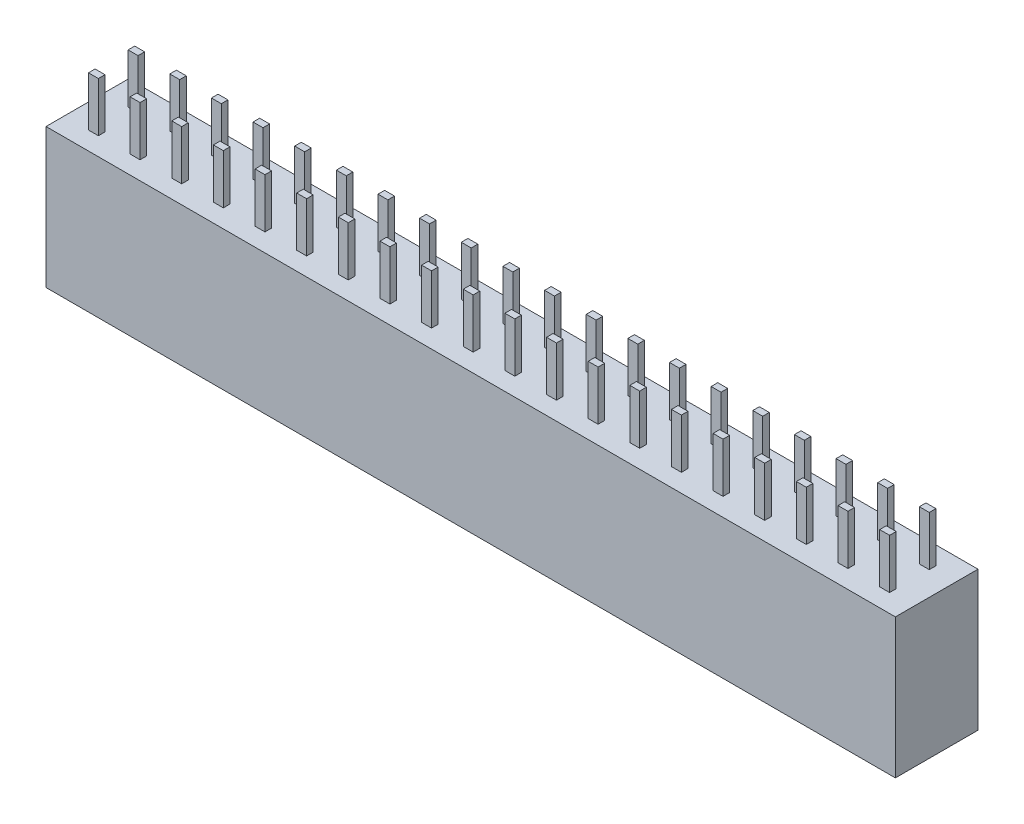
SolidWorks part; units mm, degrees
ref_plane "Front Plane" through (0, 0, 0) normal (0, 0, 1) x (1, 0, 0)
ref_plane "Top Plane" through (0, 0, 0) normal (0, 1, 0) x (1, 0, 0)
ref_plane "Right Plane" through (0, 0, 0) normal (1, 0, 0) x (0, 0, -1)
sketch "Sketch1" plane through (0, 0, 0) normal (0, 1, 0) x (1, 0, 0)
  line L1 (-25.7, 2.5) -> (25.7, 2.5)
  line L2 (-25.7, 2.5) -> (-25.7, -2.5)
  line L3 (-25.7, -2.5) -> (25.7, -2.5)
  line L4 (25.7, 2.5) -> (25.7, -2.5)
  line L5 (-25.7, 2.5) -> (25.7, -2.5) construction
  line L6 (-25.7, -2.5) -> (25.7, 2.5) construction
  point P0 (0, 0)
  dimension "D1" = 51.4
  dimension "D2" = 5
extrude "Boss-Extrude1" add sketch "Sketch1" along normal blind 8.44
sketch "Sketch2" plane through (0, 0, 0) normal (0, -1, 0) x (1, 0, 0)
  line L0 (-25.7, 2.5) -> (25.7, 2.5) construction
  line L1 (24.7, 2) -> (23.2, 2)
  line L2 (24.7, 2) -> (24.7, 0.5)
  line L3 (24.7, 0.5) -> (23.2, 0.5)
  line L4 (23.2, 2) -> (23.2, 0.5)
  line L5 (24.7, -0.5) -> (23.2, -0.5)
  line L6 (24.7, -0.5) -> (24.7, -2)
  line L7 (24.7, -2) -> (23.2, -2)
  line L8 (23.2, -0.5) -> (23.2, -2)
  line L9 (25.7, -2.5) -> (-25.7, -2.5) construction
  line L10 (25.7, 2.5) -> (25.7, -2.5) construction
  line L11 (22.18, 2) -> (20.68, 2)
  line L12 (22.18, 2) -> (22.18, 0.5)
  line L13 (22.18, 0.5) -> (20.68, 0.5)
  line L14 (20.68, 2) -> (20.68, 0.5)
  line L15 (22.18, -0.5) -> (20.68, -0.5)
  line L16 (22.18, -0.5) -> (22.18, -2)
  line L17 (22.18, -2) -> (20.68, -2)
  line L18 (20.68, -0.5) -> (20.68, -2)
  line L19 (19.66, 2) -> (18.16, 2)
  line L20 (19.66, 2) -> (19.66, 0.5)
  line L21 (19.66, 0.5) -> (18.16, 0.5)
  line L22 (18.16, 2) -> (18.16, 0.5)
  line L23 (19.66, -0.5) -> (18.16, -0.5)
  line L24 (19.66, -0.5) -> (19.66, -2)
  line L25 (19.66, -2) -> (18.16, -2)
  line L26 (18.16, -0.5) -> (18.16, -2)
  line L27 (17.14, 2) -> (15.64, 2)
  line L28 (17.14, 2) -> (17.14, 0.5)
  line L29 (17.14, 0.5) -> (15.64, 0.5)
  line L30 (15.64, 2) -> (15.64, 0.5)
  line L31 (17.14, -0.5) -> (15.64, -0.5)
  line L32 (17.14, -0.5) -> (17.14, -2)
  line L33 (17.14, -2) -> (15.64, -2)
  line L34 (15.64, -0.5) -> (15.64, -2)
  line L35 (14.62, 2) -> (13.12, 2)
  line L36 (14.62, 2) -> (14.62, 0.5)
  line L37 (14.62, 0.5) -> (13.12, 0.5)
  line L38 (13.12, 2) -> (13.12, 0.5)
  line L39 (14.62, -0.5) -> (13.12, -0.5)
  line L40 (14.62, -0.5) -> (14.62, -2)
  line L41 (14.62, -2) -> (13.12, -2)
  line L42 (13.12, -0.5) -> (13.12, -2)
  line L43 (12.1, 2) -> (10.6, 2)
  line L44 (12.1, 2) -> (12.1, 0.5)
  line L45 (12.1, 0.5) -> (10.6, 0.5)
  line L46 (10.6, 2) -> (10.6, 0.5)
  line L47 (12.1, -0.5) -> (10.6, -0.5)
  line L48 (12.1, -0.5) -> (12.1, -2)
  line L49 (12.1, -2) -> (10.6, -2)
  line L50 (10.6, -0.5) -> (10.6, -2)
  line L51 (9.58, 2) -> (8.08, 2)
  line L52 (9.58, 2) -> (9.58, 0.5)
  line L53 (9.58, 0.5) -> (8.08, 0.5)
  line L54 (8.08, 2) -> (8.08, 0.5)
  line L55 (9.58, -0.5) -> (8.08, -0.5)
  line L56 (9.58, -0.5) -> (9.58, -2)
  line L57 (9.58, -2) -> (8.08, -2)
  line L58 (8.08, -0.5) -> (8.08, -2)
  line L59 (7.06, 2) -> (5.56, 2)
  line L60 (7.06, 2) -> (7.06, 0.5)
  line L61 (7.06, 0.5) -> (5.56, 0.5)
  line L62 (5.56, 2) -> (5.56, 0.5)
  line L63 (7.06, -0.5) -> (5.56, -0.5)
  line L64 (7.06, -0.5) -> (7.06, -2)
  line L65 (7.06, -2) -> (5.56, -2)
  line L66 (5.56, -0.5) -> (5.56, -2)
  line L67 (4.54, 2) -> (3.04, 2)
  line L68 (4.54, 2) -> (4.54, 0.5)
  line L69 (4.54, 0.5) -> (3.04, 0.5)
  line L70 (3.04, 2) -> (3.04, 0.5)
  line L71 (4.54, -0.5) -> (3.04, -0.5)
  line L72 (4.54, -0.5) -> (4.54, -2)
  line L73 (4.54, -2) -> (3.04, -2)
  line L74 (3.04, -0.5) -> (3.04, -2)
  line L75 (2.02, 2) -> (0.52, 2)
  line L76 (2.02, 2) -> (2.02, 0.5)
  line L77 (2.02, 0.5) -> (0.52, 0.5)
  line L78 (0.52, 2) -> (0.52, 0.5)
  line L79 (2.02, -0.5) -> (0.52, -0.5)
  line L80 (2.02, -0.5) -> (2.02, -2)
  line L81 (2.02, -2) -> (0.52, -2)
  line L82 (0.52, -0.5) -> (0.52, -2)
  line L83 (-0.5, 2) -> (-2, 2)
  line L84 (-0.5, 2) -> (-0.5, 0.5)
  line L85 (-0.5, 0.5) -> (-2, 0.5)
  line L86 (-2, 2) -> (-2, 0.5)
  line L87 (-0.5, -0.5) -> (-2, -0.5)
  line L88 (-0.5, -0.5) -> (-0.5, -2)
  line L89 (-0.5, -2) -> (-2, -2)
  line L90 (-2, -0.5) -> (-2, -2)
  line L91 (-3.02, 2) -> (-4.52, 2)
  line L92 (-3.02, 2) -> (-3.02, 0.5)
  line L93 (-3.02, 0.5) -> (-4.52, 0.5)
  line L94 (-4.52, 2) -> (-4.52, 0.5)
  line L95 (-3.02, -0.5) -> (-4.52, -0.5)
  line L96 (-3.02, -0.5) -> (-3.02, -2)
  line L97 (-3.02, -2) -> (-4.52, -2)
  line L98 (-4.52, -0.5) -> (-4.52, -2)
  line L99 (-5.54, 2) -> (-7.04, 2)
  line L100 (-5.54, 2) -> (-5.54, 0.5)
  line L101 (-5.54, 0.5) -> (-7.04, 0.5)
  line L102 (-7.04, 2) -> (-7.04, 0.5)
  line L103 (-5.54, -0.5) -> (-7.04, -0.5)
  line L104 (-5.54, -0.5) -> (-5.54, -2)
  line L105 (-5.54, -2) -> (-7.04, -2)
  line L106 (-7.04, -0.5) -> (-7.04, -2)
  line L107 (-8.06, 2) -> (-9.56, 2)
  line L108 (-8.06, 2) -> (-8.06, 0.5)
  line L109 (-8.06, 0.5) -> (-9.56, 0.5)
  line L110 (-9.56, 2) -> (-9.56, 0.5)
  line L111 (-8.06, -0.5) -> (-9.56, -0.5)
  line L112 (-8.06, -0.5) -> (-8.06, -2)
  line L113 (-8.06, -2) -> (-9.56, -2)
  line L114 (-9.56, -0.5) -> (-9.56, -2)
  line L115 (-10.58, 2) -> (-12.08, 2)
  line L116 (-10.58, 2) -> (-10.58, 0.5)
  line L117 (-10.58, 0.5) -> (-12.08, 0.5)
  line L118 (-12.08, 2) -> (-12.08, 0.5)
  line L119 (-10.58, -0.5) -> (-12.08, -0.5)
  line L120 (-10.58, -0.5) -> (-10.58, -2)
  line L121 (-10.58, -2) -> (-12.08, -2)
  line L122 (-12.08, -0.5) -> (-12.08, -2)
  line L123 (-13.1, 2) -> (-14.6, 2)
  line L124 (-13.1, 2) -> (-13.1, 0.5)
  line L125 (-13.1, 0.5) -> (-14.6, 0.5)
  line L126 (-14.6, 2) -> (-14.6, 0.5)
  line L127 (-13.1, -0.5) -> (-14.6, -0.5)
  line L128 (-13.1, -0.5) -> (-13.1, -2)
  line L129 (-13.1, -2) -> (-14.6, -2)
  line L130 (-14.6, -0.5) -> (-14.6, -2)
  line L131 (-15.62, 2) -> (-17.12, 2)
  line L132 (-15.62, 2) -> (-15.62, 0.5)
  line L133 (-15.62, 0.5) -> (-17.12, 0.5)
  line L134 (-17.12, 2) -> (-17.12, 0.5)
  line L135 (-15.62, -0.5) -> (-17.12, -0.5)
  line L136 (-15.62, -0.5) -> (-15.62, -2)
  line L137 (-15.62, -2) -> (-17.12, -2)
  line L138 (-17.12, -0.5) -> (-17.12, -2)
  line L139 (-18.14, 2) -> (-19.64, 2)
  line L140 (-18.14, 2) -> (-18.14, 0.5)
  line L141 (-18.14, 0.5) -> (-19.64, 0.5)
  line L142 (-19.64, 2) -> (-19.64, 0.5)
  line L143 (-18.14, -0.5) -> (-19.64, -0.5)
  line L144 (-18.14, -0.5) -> (-18.14, -2)
  line L145 (-18.14, -2) -> (-19.64, -2)
  line L146 (-19.64, -0.5) -> (-19.64, -2)
  line L147 (-20.66, 2) -> (-22.16, 2)
  line L148 (-20.66, 2) -> (-20.66, 0.5)
  line L149 (-20.66, 0.5) -> (-22.16, 0.5)
  line L150 (-22.16, 2) -> (-22.16, 0.5)
  line L151 (-20.66, -0.5) -> (-22.16, -0.5)
  line L152 (-20.66, -0.5) -> (-20.66, -2)
  line L153 (-20.66, -2) -> (-22.16, -2)
  line L154 (-22.16, -0.5) -> (-22.16, -2)
  line L155 (-23.18, 2) -> (-24.68, 2)
  line L156 (-23.18, 2) -> (-23.18, 0.5)
  line L157 (-23.18, 0.5) -> (-24.68, 0.5)
  line L158 (-24.68, 2) -> (-24.68, 0.5)
  line L159 (-23.18, -0.5) -> (-24.68, -0.5)
  line L160 (-23.18, -0.5) -> (-23.18, -2)
  line L161 (-23.18, -2) -> (-24.68, -2)
  line L162 (-24.68, -0.5) -> (-24.68, -2)
  dimension "D1" = 0.5
  dimension "D2" = 0.5
  dimension "D3" = 1
  dimension "D4" = 1
  dimension "D5" = 1
  dimension "D6" = 1.5
  dimension "D7" = 20
extrude "Cut-Extrude1" cut sketch "Sketch2" against normal blind 5
sketch "Sketch3" plane through (0, 8.44, 0) normal (0, 1, 0) x (1, 0, 0)
  line L0 (23.95, 1) -> (23.95, -1) construction
  line L1 (23.65, 1.4) -> (24.25, 1.4)
  line L2 (23.65, 1.4) -> (23.65, 1)
  line L3 (23.65, 1) -> (24.25, 1)
  line L4 (24.25, 1.4) -> (24.25, 1)
  line L5 (23.65, -1) -> (24.25, -1)
  line L6 (23.65, -1) -> (23.65, -1.4)
  line L7 (23.65, -1.4) -> (24.25, -1.4)
  line L8 (24.25, -1) -> (24.25, -1.4)
  line L9 (23.95, 0) -> (25.7, 0) construction
  line L10 (25.7, -2.5) -> (25.7, 2.5) construction
  line L12 (23.95, 1.4) -> (23.95, 2) construction
  line L13 (23.2, 2) -> (24.7, 2) construction
  line L14 (21.13, 1) -> (21.73, 1)
  line L15 (21.73, 1.4) -> (21.73, 1)
  line L16 (21.13, 1.4) -> (21.73, 1.4)
  line L17 (21.13, 1.4) -> (21.13, 1)
  line L18 (21.13, -1) -> (21.13, -1.4)
  line L19 (21.13, -1) -> (21.73, -1)
  line L20 (21.13, -1.4) -> (21.73, -1.4)
  line L21 (21.73, -1) -> (21.73, -1.4)
  line L22 (18.61, 1) -> (19.21, 1)
  line L23 (19.21, 1.4) -> (19.21, 1)
  line L24 (18.61, 1.4) -> (19.21, 1.4)
  line L25 (18.61, 1.4) -> (18.61, 1)
  line L26 (18.61, -1) -> (18.61, -1.4)
  line L27 (18.61, -1) -> (19.21, -1)
  line L28 (18.61, -1.4) -> (19.21, -1.4)
  line L29 (19.21, -1) -> (19.21, -1.4)
  line L30 (16.09, 1) -> (16.69, 1)
  line L31 (16.69, 1.4) -> (16.69, 1)
  line L32 (16.09, 1.4) -> (16.69, 1.4)
  line L33 (16.09, 1.4) -> (16.09, 1)
  line L34 (16.09, -1) -> (16.09, -1.4)
  line L35 (16.09, -1) -> (16.69, -1)
  line L36 (16.09, -1.4) -> (16.69, -1.4)
  line L37 (16.69, -1) -> (16.69, -1.4)
  line L38 (13.57, 1) -> (14.17, 1)
  line L39 (14.17, 1.4) -> (14.17, 1)
  line L40 (13.57, 1.4) -> (14.17, 1.4)
  line L41 (13.57, 1.4) -> (13.57, 1)
  line L42 (13.57, -1) -> (13.57, -1.4)
  line L43 (13.57, -1) -> (14.17, -1)
  line L44 (13.57, -1.4) -> (14.17, -1.4)
  line L45 (14.17, -1) -> (14.17, -1.4)
  line L46 (11.05, 1) -> (11.65, 1)
  line L47 (11.65, 1.4) -> (11.65, 1)
  line L48 (11.05, 1.4) -> (11.65, 1.4)
  line L49 (11.05, 1.4) -> (11.05, 1)
  line L50 (11.05, -1) -> (11.05, -1.4)
  line L51 (11.05, -1) -> (11.65, -1)
  line L52 (11.05, -1.4) -> (11.65, -1.4)
  line L53 (11.65, -1) -> (11.65, -1.4)
  line L54 (8.53, 1) -> (9.13, 1)
  line L55 (9.13, 1.4) -> (9.13, 1)
  line L56 (8.53, 1.4) -> (9.13, 1.4)
  line L57 (8.53, 1.4) -> (8.53, 1)
  line L58 (8.53, -1) -> (8.53, -1.4)
  line L59 (8.53, -1) -> (9.13, -1)
  line L60 (8.53, -1.4) -> (9.13, -1.4)
  line L61 (9.13, -1) -> (9.13, -1.4)
  line L62 (6.01, 1) -> (6.61, 1)
  line L63 (6.61, 1.4) -> (6.61, 1)
  line L64 (6.01, 1.4) -> (6.61, 1.4)
  line L65 (6.01, 1.4) -> (6.01, 1)
  line L66 (6.01, -1) -> (6.01, -1.4)
  line L67 (6.01, -1) -> (6.61, -1)
  line L68 (6.01, -1.4) -> (6.61, -1.4)
  line L69 (6.61, -1) -> (6.61, -1.4)
  line L70 (3.49, 1) -> (4.09, 1)
  line L71 (4.09, 1.4) -> (4.09, 1)
  line L72 (3.49, 1.4) -> (4.09, 1.4)
  line L73 (3.49, 1.4) -> (3.49, 1)
  line L74 (3.49, -1) -> (3.49, -1.4)
  line L75 (3.49, -1) -> (4.09, -1)
  line L76 (3.49, -1.4) -> (4.09, -1.4)
  line L77 (4.09, -1) -> (4.09, -1.4)
  line L78 (0.97, 1) -> (1.57, 1)
  line L79 (1.57, 1.4) -> (1.57, 1)
  line L80 (0.97, 1.4) -> (1.57, 1.4)
  line L81 (0.97, 1.4) -> (0.97, 1)
  line L82 (0.97, -1) -> (0.97, -1.4)
  line L83 (0.97, -1) -> (1.57, -1)
  line L84 (0.97, -1.4) -> (1.57, -1.4)
  line L85 (1.57, -1) -> (1.57, -1.4)
  line L86 (-1.55, 1) -> (-0.95, 1)
  line L87 (-0.95, 1.4) -> (-0.95, 1)
  line L88 (-1.55, 1.4) -> (-0.95, 1.4)
  line L89 (-1.55, 1.4) -> (-1.55, 1)
  line L90 (-1.55, -1) -> (-1.55, -1.4)
  line L91 (-1.55, -1) -> (-0.95, -1)
  line L92 (-1.55, -1.4) -> (-0.95, -1.4)
  line L93 (-0.95, -1) -> (-0.95, -1.4)
  line L94 (-4.07, 1) -> (-3.47, 1)
  line L95 (-3.47, 1.4) -> (-3.47, 1)
  line L96 (-4.07, 1.4) -> (-3.47, 1.4)
  line L97 (-4.07, 1.4) -> (-4.07, 1)
  line L98 (-4.07, -1) -> (-4.07, -1.4)
  line L99 (-4.07, -1) -> (-3.47, -1)
  line L100 (-4.07, -1.4) -> (-3.47, -1.4)
  line L101 (-3.47, -1) -> (-3.47, -1.4)
  line L102 (-6.59, 1) -> (-5.99, 1)
  line L103 (-5.99, 1.4) -> (-5.99, 1)
  line L104 (-6.59, 1.4) -> (-5.99, 1.4)
  line L105 (-6.59, 1.4) -> (-6.59, 1)
  line L106 (-6.59, -1) -> (-6.59, -1.4)
  line L107 (-6.59, -1) -> (-5.99, -1)
  line L108 (-6.59, -1.4) -> (-5.99, -1.4)
  line L109 (-5.99, -1) -> (-5.99, -1.4)
  line L110 (-9.11, 1) -> (-8.51, 1)
  line L111 (-8.51, 1.4) -> (-8.51, 1)
  line L112 (-9.11, 1.4) -> (-8.51, 1.4)
  line L113 (-9.11, 1.4) -> (-9.11, 1)
  line L114 (-9.11, -1) -> (-9.11, -1.4)
  line L115 (-9.11, -1) -> (-8.51, -1)
  line L116 (-9.11, -1.4) -> (-8.51, -1.4)
  line L117 (-8.51, -1) -> (-8.51, -1.4)
  line L118 (-11.63, 1) -> (-11.03, 1)
  line L119 (-11.03, 1.4) -> (-11.03, 1)
  line L120 (-11.63, 1.4) -> (-11.03, 1.4)
  line L121 (-11.63, 1.4) -> (-11.63, 1)
  line L122 (-11.63, -1) -> (-11.63, -1.4)
  line L123 (-11.63, -1) -> (-11.03, -1)
  line L124 (-11.63, -1.4) -> (-11.03, -1.4)
  line L125 (-11.03, -1) -> (-11.03, -1.4)
  line L126 (-14.15, 1) -> (-13.55, 1)
  line L127 (-13.55, 1.4) -> (-13.55, 1)
  line L128 (-14.15, 1.4) -> (-13.55, 1.4)
  line L129 (-14.15, 1.4) -> (-14.15, 1)
  line L130 (-14.15, -1) -> (-14.15, -1.4)
  line L131 (-14.15, -1) -> (-13.55, -1)
  line L132 (-14.15, -1.4) -> (-13.55, -1.4)
  line L133 (-13.55, -1) -> (-13.55, -1.4)
  line L134 (-16.67, 1) -> (-16.07, 1)
  line L135 (-16.07, 1.4) -> (-16.07, 1)
  line L136 (-16.67, 1.4) -> (-16.07, 1.4)
  line L137 (-16.67, 1.4) -> (-16.67, 1)
  line L138 (-16.67, -1) -> (-16.67, -1.4)
  line L139 (-16.67, -1) -> (-16.07, -1)
  line L140 (-16.67, -1.4) -> (-16.07, -1.4)
  line L141 (-16.07, -1) -> (-16.07, -1.4)
  line L142 (-19.19, 1) -> (-18.59, 1)
  line L143 (-18.59, 1.4) -> (-18.59, 1)
  line L144 (-19.19, 1.4) -> (-18.59, 1.4)
  line L145 (-19.19, 1.4) -> (-19.19, 1)
  line L146 (-19.19, -1) -> (-19.19, -1.4)
  line L147 (-19.19, -1) -> (-18.59, -1)
  line L148 (-19.19, -1.4) -> (-18.59, -1.4)
  line L149 (-18.59, -1) -> (-18.59, -1.4)
  line L150 (-21.71, 1) -> (-21.11, 1)
  line L151 (-21.11, 1.4) -> (-21.11, 1)
  line L152 (-21.71, 1.4) -> (-21.11, 1.4)
  line L153 (-21.71, 1.4) -> (-21.71, 1)
  line L154 (-21.71, -1) -> (-21.71, -1.4)
  line L155 (-21.71, -1) -> (-21.11, -1)
  line L156 (-21.71, -1.4) -> (-21.11, -1.4)
  line L157 (-21.11, -1) -> (-21.11, -1.4)
  line L158 (-24.23, 1) -> (-23.63, 1)
  line L159 (-23.63, 1.4) -> (-23.63, 1)
  line L160 (-24.23, 1.4) -> (-23.63, 1.4)
  line L161 (-24.23, 1.4) -> (-24.23, 1)
  line L162 (-24.23, -1) -> (-24.23, -1.4)
  line L163 (-24.23, -1) -> (-23.63, -1)
  line L164 (-24.23, -1.4) -> (-23.63, -1.4)
  line L165 (-23.63, -1) -> (-23.63, -1.4)
  dimension "D1" = 0.4
  dimension "D2" = 0.6
  dimension "D3" = 2.8
  dimension "D4" = 20
extrude "Boss-Extrude2" add sketch "Sketch3" along normal blind 3
